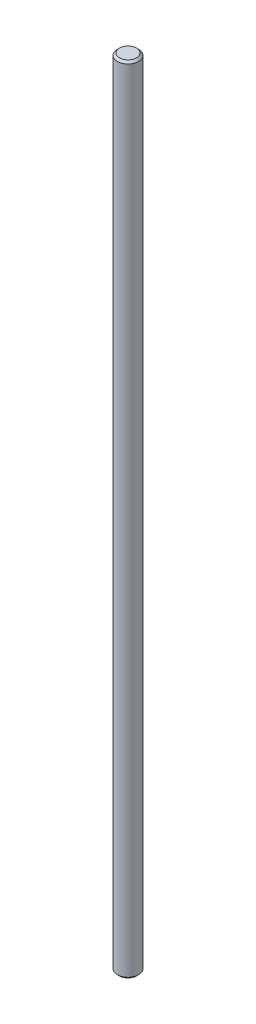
SolidWorks part; units mm, degrees
ref_plane "Front" through (0, 0, 0) normal (0, 0, 1) x (1, 0, 0)
ref_plane "Top" through (0, 0, 0) normal (0, 1, 0) x (1, 0, 0)
ref_plane "Right" through (0, 0, 0) normal (1, 0, 0) x (0, 0, -1)
sketch "Sketch1" plane through (0, 0, 0) normal (0, 1, 0) x (1, 0, 0)
  circle A0 centre (0, 0) radius 2
extrude "Extrude1" add sketch "Sketch1" along normal blind 150
chamfer "Chamfer1" distance 0.4 angle 45 2 edges at (0, 0, 2) (0, 150, 2)
